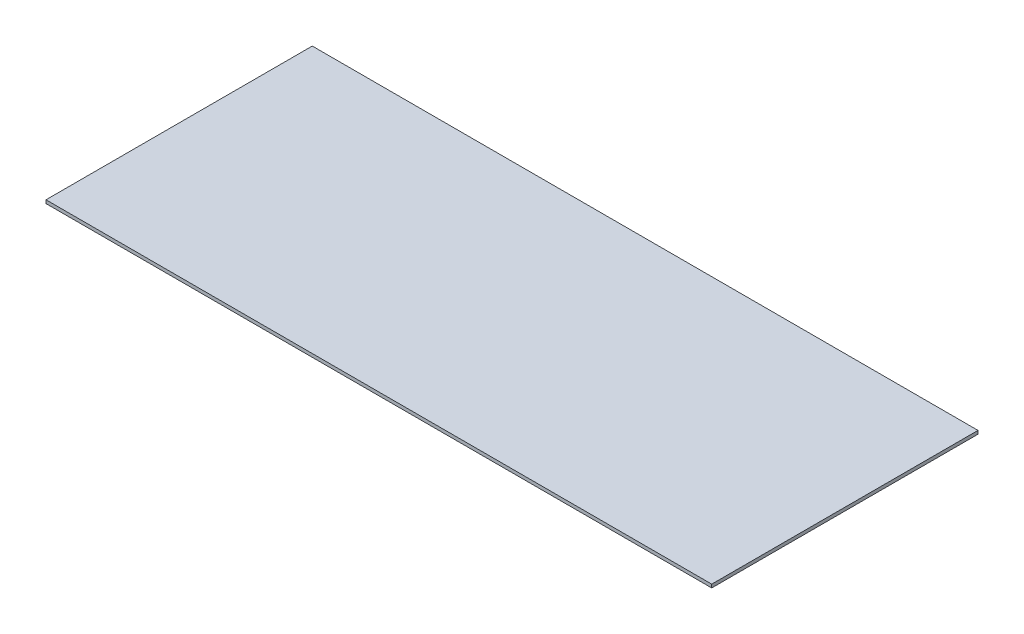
SolidWorks part; units mm, degrees
ref_plane "Plan de face" through (0, 0, 0) normal (0, 0, 1) x (1, 0, 0)
ref_plane "Plan de dessus" through (0, 0, 0) normal (0, 1, 0) x (1, 0, 0)
ref_plane "Plan de droite" through (0, 0, 0) normal (1, 0, 0) x (0, 0, -1)
sketch "Esquisse1" plane through (0, 0, 0) normal (0, 0, 1) x (1, 0, 0)
  line L1 (0, 0) -> (-2000, 0)
  line L2 (0, 0) -> (0, 10)
  line L3 (0, 10) -> (-2000, 10)
  line L4 (-2000, 0) -> (-2000, 10)
  dimension "D1" = 10
  dimension "D2" = 2000
extrude "Extrusion1" add sketch "Esquisse1" along normal blind 800
